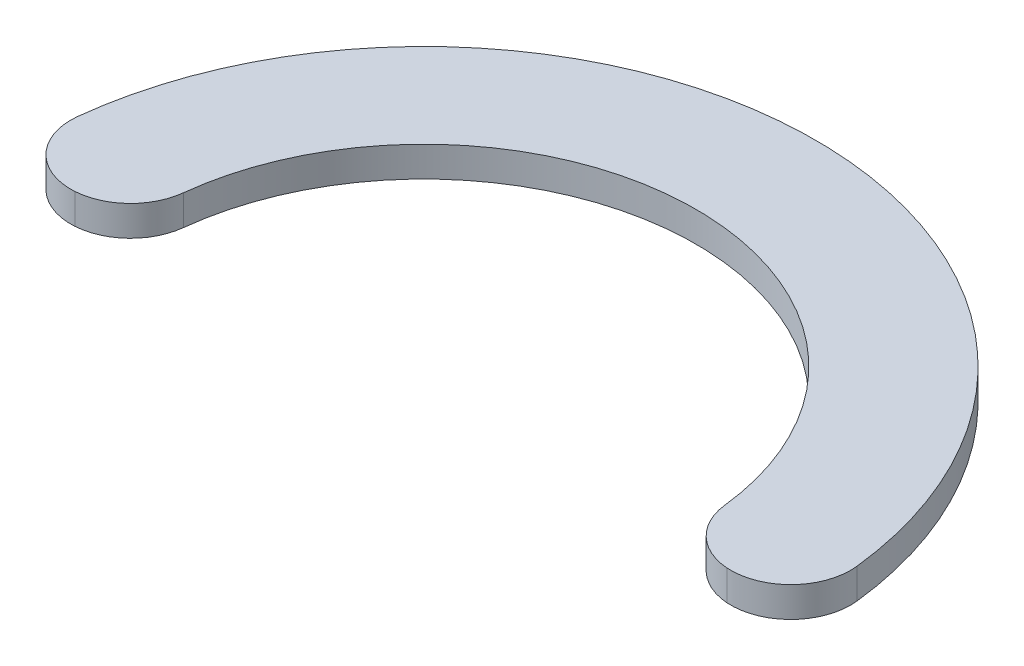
SolidWorks part; units mm, degrees
ref_plane "Front" through (0, 0, 0) normal (0, 0, 1) x (1, 0, 0)
ref_plane "Top" through (0, 0, 0) normal (0, 1, 0) x (1, 0, 0)
ref_plane "Right" through (0, 0, 0) normal (1, 0, 0) x (0, 0, -1)
sketch "Sketch1" plane through (0, 0, 0) normal (0, 1, 0) x (1, 0, 0)
  line L0 (0, 0) -> (-43.8928, -3.0693) construction
  line L1 (0, 0) -> (43.8928, -3.0693) construction
  line L2 (0, 0) -> (0, 88.944) construction
  arc A0 (-43.8928, -3.0693) -> (43.8928, -3.0693) centre (0, 0) cw
  dimension "D3" = 44
  dimension "D1" = 94
  dimension "D2" = 94
extrude "Extrude-Thin1" add sketch "Sketch1" along normal blind 4 thin
fillet "Fillet1" radius 7.9375 4 edges at (51.7985, 2, 3.6221) (35.9871, 2, 2.5165) (-51.7985, 2, 3.6221) (-35.9871, 2, 2.5165)
